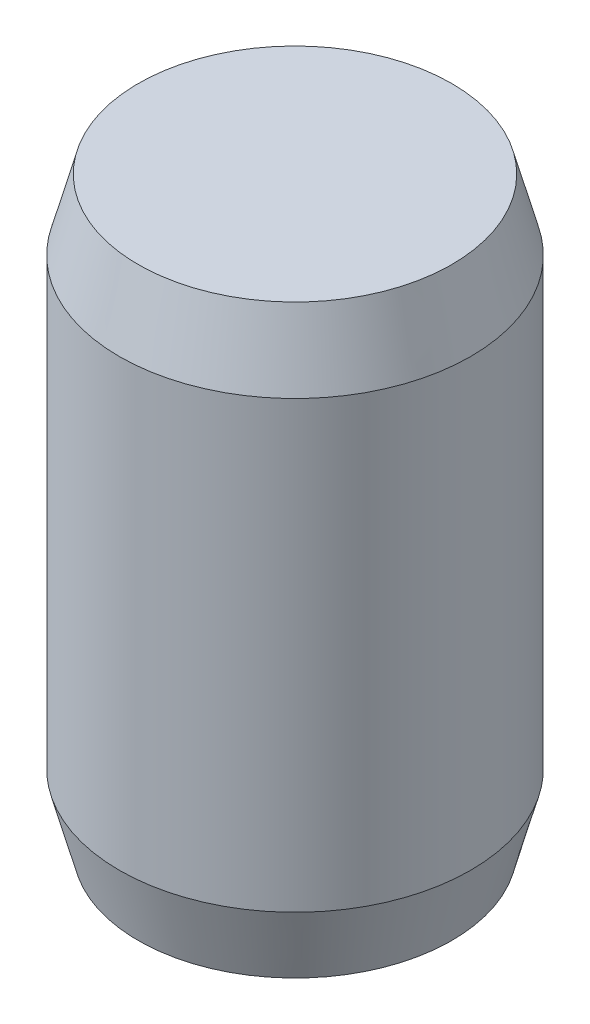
SolidWorks part; units mm, degrees
ref_plane "Face" through (0, 0, 0) normal (0, 0, 1) x (1, 0, 0)
ref_plane "Dessus" through (0, 0, 0) normal (0, 1, 0) x (1, 0, 0)
ref_plane "Droite" through (0, 0, 0) normal (1, 0, 0) x (0, 0, -1)
sketch "Esquisse1" plane through (0, 0, 0) normal (0, 0, 1) x (1, 0, 0)
  line L1 (3, -8.8) -> (3, -1.2)
  line L2 (0, 0) -> (0, -20.7306) construction
  line L3 (3, -8.8) -> (2.6785, -10)
  line L4 (0, 0) -> (0, -10)
  line L5 (0, -10) -> (2.6785, -10)
  line L6 (-3, 0) -> (3, 0) construction
  line L7 (0, 0) -> (2.6785, 0)
  line L8 (3, -1.2) -> (2.6785, 0)
  line L9 (0, 0) -> (0, 5.0587) construction
  dimension "D1" = 15
  dimension "D2" = 15
  dimension "Longueur" = 10
  dimension "Hauteur chamfrein" = 1.2
  dimension "Rn" = 3
  dimension "Diamètre nominal" = 6
revolve "Base-Révolution" add sketch "Esquisse1" angle 360 about L9
equation "\"Rn@Esquisse1\" = \"Diamètre nominal@Esquisse1\"/2"
